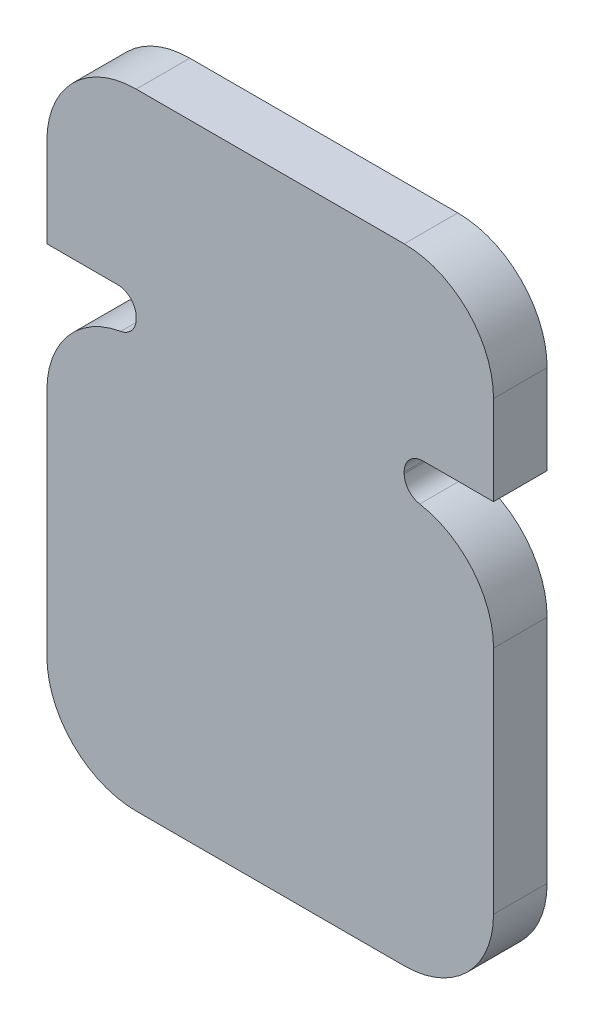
SolidWorks part; units mm, degrees
ref_plane "Plan de face" through (0, 0, 0) normal (0, 0, 1) x (1, 0, 0)
ref_plane "Plan de dessus" through (0, 0, 0) normal (0, 1, 0) x (1, 0, 0)
ref_plane "Plan de droite" through (0, 0, 0) normal (1, 0, 0) x (0, 0, -1)
sketch "Esquisse1" plane through (0, 0, 0) normal (0, 0, 1) x (1, 0, 0)
  line L0 (-50, 30) -> (-50, 20)
  line L1 (-50, 30) -> (-25, 30)
  line L2 (-50, 17.9) -> (-50, -5)
  line L3 (-50, -5) -> (-25, -5)
  line L4 (-25, 17.9) -> (-25, -5)
  line L5 (-50, 20) -> (-45, 20)
  line L6 (-25, 20) -> (-30, 20)
  line L7 (-50, 17.9) -> (-45, 17.9)
  line L8 (-45, 20) -> (-45, 17.9)
  line L9 (-30, 20) -> (-30, 17.9)
  line L10 (-30, 17.9) -> (-25, 17.9)
  line L11 (-25, 30) -> (-25, 20)
  dimension "D1" = 25
  dimension "D2" = 35
  dimension "D3" = 5
  dimension "D4" = 2.1
  dimension "D5" = 10
  dimension "D6" = 5
  dimension "D7" = 2.1
extrude "Extrusion1" add sketch "Esquisse1" along normal blind 3
fillet "Congé3" radius 5 4 edges at (-25, 30, 1.5) (-25, -5, 1.5) (-50, -5, 1.5) (-50, 30, 1.5)
sketch "Esquisse2" plane through (0, 0, 3) normal (0, 0, 1) x (1, 0, 0)
  text T0 "1" font "Arial" height 3.5
fillet "Congé4" radius 5 6 edges at (-27.5, 17.9, 0) (-47.5, 17.9, 0) (-47.5, 17.9, 3) (-25, 17.9, 1.5) (-50, 17.9, 1.5) (-27.5, 17.9, 3)
fillet "Congé5" radius 1.05 4 edges at (-30, 20, 1.5) (-30, 17.9, 1.5) (-45, 17.9, 1.5) (-45, 20, 1.5)
